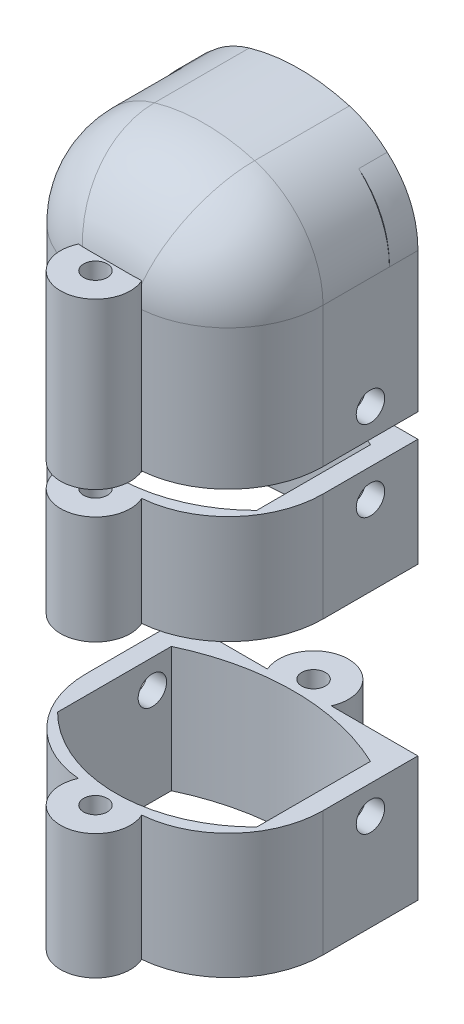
SolidWorks part; units mm, degrees
ref_plane "Alzado" through (0, 0, 0) normal (0, 0, 1) x (1, 0, 0)
ref_plane "Planta" through (0, 0, 0) normal (0, 1, 0) x (1, 0, 0)
ref_plane "Vista lateral" through (0, 0, 0) normal (1, 0, 0) x (0, 0, -1)
sketch "Croquis1" plane through (0, 0, 0) normal (0, 0, 1) x (1, 0, 0)
  line L1 (-18.6681, -47.5) -> (6.3319, -47.5)
  line L2 (-18.6681, -47.5) -> (-18.6681, 17.5)
  line L4 (6.3319, -47.5) -> (6.3319, 17.5)
  arc A0 (-18.6681, 17.5) -> (6.3319, 17.5) centre (-6.1681, 3.2195) cw
  point P0 (-2.2125, 0)
  dimension "D1" = 65
  dimension "D2" = 25
  dimension "D3" = 65
extrude "Saliente-Extruir1" add sketch "Croquis1" along normal blind 20
fillet "Redondeo1" radius 10 2 edges at (-18.6681, 17.5, 10) (6.3319, 17.5, 10)
fillet "Redondeo2" radius 10 5 edges at (-18.6681, -17.8285, 20) (-16.6633, 17.8494, 20) (-6.1681, 22.198, 20) (4.327, 17.8494, 20) (6.3319, -17.8285, 20)
sketch "Croquis2" plane through (0, 0, 20) normal (0, 0, 1) x (1, 0, 0)
sketch "Croquis4" plane through (0, 0, 0) normal (0, 0, -1) x (-1, 0, 0)
  line L0 (18.6681, -47.5) -> (-6.3319, -47.5) construction
  line L2 (-4.3319, 12.5) -> (-4.3319, -47.5)
  line L3 (-4.3319, -47.5) -> (16.6681, -47.5)
  line L4 (16.6681, 12.5) -> (16.6681, -47.5)
  line L5 (-6.3319, -47.5) -> (-6.3319, 11.8429) construction
  line L6 (18.6681, 11.8429) -> (18.6681, -47.5) construction
  arc A1 (-4.3319, 12.5) -> (16.6681, 12.5) centre (6.1681, 9.2893) cw
  dimension "D1" = 2
  dimension "D2" = 2
  dimension "D3" = 60
  dimension "D4" = 60
extrude "Cortar-Extruir1" cut sketch "Croquis4" against normal blind 15
sketch "Croquis5" plane through (0, -47.5, 0) normal (0, -1, 0) x (1, 0, 0)
  line L0 (-16.6681, 15) -> (4.3319, 15)
  arc A0 (-16.6681, 15) -> (4.3319, 15) centre (-6.1681, 4.5) cw
extrude "Cortar-Extruir2" cut sketch "Croquis5" against normal blind 61
sketch "Croquis7" plane through (0, 13.5, 0) normal (0, -1, 0) x (1, 0, 0)
  line L0 (-16.3086, 15) -> (3.9723, 15) construction
  line L1 (3.9723, 15) -> (-16.3086, 15) construction
  line L2 (-15.0228, 15) -> (3.4348, 15)
  arc A0 (-15.0228, 15) -> (3.4348, 15) centre (-5.794, 5.7712) cw
extrude "Cortar-Extruir4" cut sketch "Croquis7" against normal blind 3
sketch "Croquis9" plane through (0, -47.5, 0) normal (0, -1, 0) x (1, 0, 0)
  line L0 (-6.1681, 20) -> (-6.1681, 0) construction
  line L1 (-16.6681, 0) -> (4.3319, 0) construction
  line L2 (-8.6681, 20) -> (-3.6681, 20) construction
  line L3 (-7.6681, 21.5) -> (-8.6681, 20)
  line L4 (-4.6681, 21.5) -> (-3.6681, 20)
  line L5 (-3.6681, 20) -> (-8.6681, 20)
  line L6 (-6.1681, 10) -> (6.3319, 10) construction
  line L7 (-3.6681, 0) -> (-8.6681, 0)
  line L8 (-4.6681, -1.5) -> (-3.6681, 0)
  line L9 (-7.6681, -1.5) -> (-8.6681, 0)
  arc A1 (-4.6681, 21.5) -> (-7.6681, 21.5) centre (-6.1681, 21.5) ccw
  arc A2 (-4.6681, -1.5) -> (-7.6681, -1.5) centre (-6.1681, -1.5) cw
  dimension "D1" = 3
  dimension "D2" = 1.5
extrude "Saliente-Extruir2" add sketch "Croquis9" against normal blind 62
sketch "Croquis10" plane through (0, -47.5, 0) normal (0, -1, 0) x (1, 0, 0)
  circle A0 centre (-6.1681, 21.5) radius 1.25
  dimension "D1" = 2.5
extrude "Cortar-Extruir5" cut sketch "Croquis10" against normal blind 65
sketch "Croquis11" plane through (0, 0, 0) normal (0, 0, -1) x (-1, 0, 0)
  line L0 (-6.3319, -47.5) -> (18.6681, -47.5)
  line L1 (18.6681, -47.5) -> (18.6681, 11.8429)
  line L3 (-6.3319, 11.8429) -> (-6.3319, -47.5)
  arc A0 (4.6667, 22.1091) -> (6.1681, 22.198) centre (6.1681, 9.4758) cw
  arc A1 (0.8837, 21.4474) -> (-6.3319, 11.8429) centre (3.6681, 11.8429) ccw construction
  arc A2 (18.6681, 11.8429) -> (11.4526, 21.4474) centre (8.6681, 11.8429) ccw construction
  spline S0 degree 3 poles (-6.3319, 11.8429) (-6.3784, 18.2986) (-1.0827, 21.8105) (4.6667, 22.1091) knots 0 0 0 0 0.484714 0.484714 0.484714 0.484714
  spline S1 degree 3 poles (18.6681, 11.8429) (19.0349, 19.2719) (11.9658, 21.9641) (6.1681, 22.198) knots 0 0 0 0 1 1 1 1
extrude "Saliente-Extruir3" add sketch "Croquis11" against normal blind 3
sketch "Croquis12" plane through (0, -47.5, 0) normal (0, -1, 0) x (1, 0, 0)
  line L0 (-16.6681, 3) -> (4.3319, 3)
  arc A0 (-16.6681, 3) -> (4.3319, 3) centre (-6.1681, 25.0369) ccw
extrude "Cortar-Extruir6" cut sketch "Croquis12" against normal blind 63
sketch "Croquis13" plane through (0, -47.5, 0) normal (0, -1, 0) x (1, 0, 0)
  circle A0 centre (-6.1681, -1.5) radius 1.25
  dimension "D1" = 2.5
extrude "Cortar-Extruir7" cut sketch "Croquis13" against normal blind 63
sketch "Croquis14" plane through (0, 0, 0) normal (0, 0, 1) x (1, 0, 0)
  line L3 (-18.6681, -47.5) -> (-18.6681, 11.8429) construction
  line L4 (-18.6681, -2.893) -> (6.3319, -2.893)
  line L5 (-18.6681, -2.893) -> (-18.6681, -5.393)
  line L6 (-18.6681, -5.393) -> (6.3319, -5.393)
  line L7 (6.3319, -2.893) -> (6.3319, -5.393)
  line L8 (6.3319, 11.8429) -> (6.3319, -47.5) construction
  line L11 (-18.6681, -31.8152) -> (6.3319, -31.8152)
  line L12 (-18.6681, -31.8152) -> (-18.6681, -34.3152)
  line L13 (-18.6681, -34.3152) -> (6.3319, -34.3152)
  line L14 (6.3319, -31.8152) -> (6.3319, -34.3152)
  dimension "D2" = 2.5
  dimension "D4" = 2.5
extrude "Cortar-Extruir8" cut sketch "Croquis14" against normal through all both and the other way through all
sketch "Croquis15" plane through (6.3319, 0, 0) normal (1, 0, 0) x (0, 0, -1)
  line L0 (0, -2.893) -> (-10, -2.893) construction
  line L1 (0, -5.393) -> (-10, -5.393) construction
  line L2 (0, -31.8152) -> (-10, -31.8152) construction
  line L3 (0, -34.3152) -> (-10, -34.3152) construction
  circle A0 centre (-5, 0.107) radius 1.5
  circle A1 centre (-5, -8.393) radius 1.5
  circle A2 centre (-5, -28.8152) radius 1.5
  circle A3 centre (-5, -37.3152) radius 1.5
  dimension "D1" = 3
  dimension "D3" = 3
  dimension "D5" = 3
  dimension "D8" = 3
  dimension "D2" = 3
  dimension "D4" = 3
  dimension "D6" = 3
  dimension "D7" = 3
extrude "Cortar-Extruir9" cut sketch "Croquis15" against normal through all both and the other way through all
sketch "Croquis16" plane through (0, 0, 0) normal (0, 0, -1) x (-1, 0, 0)
  line L0 (-6.3319, -31.8152) -> (-6.3319, -5.393) construction
  line L1 (-6.3319, -16.8152) -> (18.6681, -16.8152)
  line L2 (-6.3319, -16.8152) -> (-6.3319, -31.8152)
  line L3 (-6.3319, -31.8152) -> (18.6681, -31.8152)
  line L4 (18.6681, -16.8152) -> (18.6681, -31.8152)
  dimension "D1" = 15
extrude "Cortar-Extruir10" cut sketch "Croquis16" against normal through all both and the other way through all
sketch "Croquis17" plane through (0, 16.5, 0) normal (0, -1, 0) x (1, 0, 0)
  line L0 (2.1123, 15) -> (3.4348, 15) construction
  line L1 (-15.0228, 15) -> (3.4348, 15)
  arc A0 (-15.0228, 15) -> (3.4348, 15) centre (-5.794, 5.7712) cw
  arc A1 (3.4348, 15) -> (-15.0228, 15) centre (-5.794, 5.7712) ccw construction
extrude "Saliente-Extruir4" add sketch "Croquis17" along normal blind 18
sketch "Croquis18" plane through (0, -47.5, 0) normal (0, -1, 0) x (1, 0, 0)
  line L0 (-9.5121, 19.9643) -> (-8.6681, 20)
  line L1 (-8.6681, 20) -> (-7.6681, 21.5)
  line L2 (-4.6681, 21.5) -> (-3.6681, 20)
  line L3 (-3.6681, 20) -> (-4.6681, 21.5) construction
  line L4 (-3.6681, 20) -> (-2.8241, 19.9643)
  line L7 (-9.5121, 0.0357) -> (-8.6681, 0)
  line L8 (-3.6681, 0) -> (-2.8241, 0.0357)
  line L9 (-4.6681, -1.5) -> (-3.6681, 0)
  line L10 (-8.6681, 0) -> (-7.6681, -1.5)
  arc A0 (-2.8241, 19.9643) -> (-9.5121, 19.9643) centre (-6.1681, 21.5) ccw
  arc A1 (-8.6681, 20) -> (-18.6681, 10) centre (-8.6681, 10) ccw construction
  arc A2 (6.3319, 10) -> (-3.6681, 20) centre (-3.6681, 10) ccw construction
  arc A3 (-7.6681, 21.5) -> (-4.6681, 21.5) centre (-6.1681, 21.5) cw
  arc A4 (-7.6681, -1.5) -> (-4.6681, -1.5) centre (-6.1681, -1.5) ccw
  arc A5 (-2.8241, 0.0357) -> (-9.5121, 0.0357) centre (-6.1681, -1.5) cw
extrude "Saliente-Extruir5" add sketch "Croquis18" against normal blind 62
sketch "Croquis19" plane through (0, 0, 15) normal (0, 0, -1) x (-1, 0, 0)
  line L1 (-6.3319, -2.893) -> (18.6681, -2.893)
  line L2 (-6.3319, -2.893) -> (-6.3319, -5.393)
  line L3 (-6.3319, -5.393) -> (18.6681, -5.393)
  line L4 (18.6681, -2.893) -> (18.6681, -5.393)
  line L5 (-6.3319, -16.8152) -> (18.6681, -16.8152)
  line L6 (-6.3319, -16.8152) -> (-6.3319, -34.3152)
  line L7 (-6.3319, -34.3152) -> (18.6681, -34.3152)
  line L8 (18.6681, -16.8152) -> (18.6681, -34.3152)
extrude "Cortar-Extruir11" cut sketch "Croquis19" along normal blind 30 and the other way blind 38
